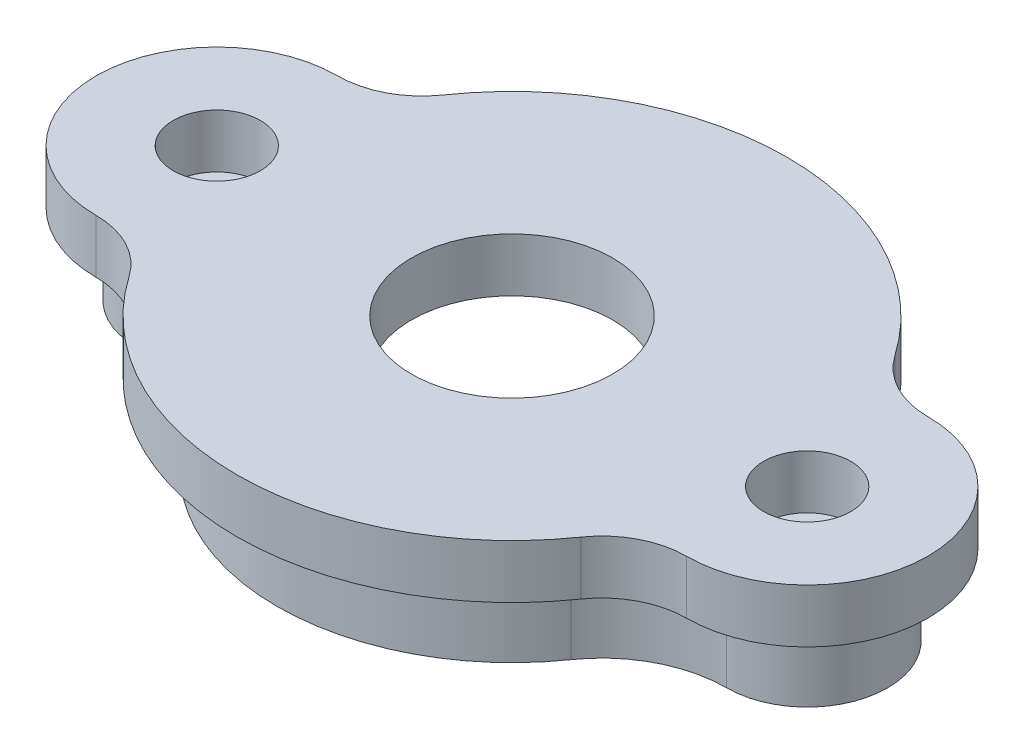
SolidWorks part; units mm, degrees
ref_plane "Ön Düzlem" through (0, 0, 0) normal (0, 0, 1) x (1, 0, 0)
ref_plane "Üst Düzlem" through (0, 0, 0) normal (0, 1, 0) x (1, 0, 0)
ref_plane "Sağ Düzlem" through (0, 0, 0) normal (1, 0, 0) x (0, 0, -1)
sketch "Sketch1" plane through (0, 0, 0) normal (0, 1, 0) x (1, 0, 0)
  line L0 (22, 9) -> (22, -9) construction
  line L1 (0, 0) -> (22, 0) construction
  line L2 (0, 0) -> (0, 20.5) construction
  arc A0 (-16.8325, -11.7012) -> (16.8325, -11.7012) centre (0, 0) ccw
  arc A2 (22, -9) -> (22, 9) centre (22, 0) ccw
  arc A3 (22, 9) -> (16.8325, 11.7012) centre (22, 15.2935) cw
  arc A4 (22, -9) -> (16.8325, -11.7012) centre (22, -15.2935) ccw
  arc A5 (-22, -9) -> (-16.8325, -11.7012) centre (-22, -15.2935) cw
  arc A6 (-22, -9) -> (-22, 9) centre (-22, 0) cw
  arc A7 (-22, 9) -> (-16.8325, 11.7012) centre (-22, 15.2935) ccw
  arc A8 (16.8325, 11.7012) -> (-16.8325, 11.7012) centre (0, 0) ccw
  dimension "D1" = 41
  dimension "D2" = 9
  dimension "D3" = 22
extrude "Boss-Extrude1" add sketch "Sketch1" along normal blind 4
sketch "Sketch2" plane through (0, 0, 0) normal (0, -1, 0) x (1, 0, 0)
  arc A0 (14.3692, 9.9888) -> (-14.3692, 9.9888) centre (0, 0) ccw
  arc A1 (-22, 6) -> (-14.3692, 9.9888) centre (-22, 15.2935) ccw
  arc A2 (-22, 6) -> (-22, -6) centre (-22, 0) ccw
  arc A3 (-14.3692, -9.9888) -> (-22, -6) centre (-22, -15.2935) ccw
  arc A4 (-14.3692, -9.9888) -> (14.3692, -9.9888) centre (0, 0) ccw
  arc A5 (22, -6) -> (14.3692, -9.9888) centre (22, -15.2935) ccw
  arc A6 (22, -6) -> (22, 6) centre (22, 0) ccw
  arc A7 (14.3692, 9.9888) -> (22, 6) centre (22, 15.2935) ccw
  arc A8 (22, -9) -> (16.8325, -11.7012) centre (22, -15.2935) ccw
  arc A9 (22, -9) -> (22, 9) centre (22, 0) ccw
  arc A10 (16.8325, 11.7012) -> (22, 9) centre (22, 15.2935) ccw
  arc A11 (16.8325, 11.7012) -> (-16.8325, 11.7012) centre (0, 0) ccw
  arc A12 (-22, 9) -> (-16.8325, 11.7012) centre (-22, 15.2935) ccw
  arc A13 (-22, 9) -> (-22, -9) centre (-22, 0) ccw
  arc A14 (-16.8325, -11.7012) -> (-22, -9) centre (-22, -15.2935) ccw
  arc A15 (-16.8325, -11.7012) -> (16.8325, -11.7012) centre (0, 0) ccw
  arc A16 (22, -9) -> (16.8325, -11.7012) centre (22, -15.2935) ccw
  arc A17 (22, -9) -> (22, 9) centre (22, 0) ccw
  arc A18 (16.8325, 11.7012) -> (22, 9) centre (22, 15.2935) ccw
  arc A19 (16.8325, 11.7012) -> (-16.8325, 11.7012) centre (0, 0) ccw
  arc A20 (-22, 9) -> (-16.8325, 11.7012) centre (-22, 15.2935) ccw
  arc A21 (-22, 9) -> (-22, -9) centre (-22, 0) ccw
  arc A22 (-16.8325, -11.7012) -> (-22, -9) centre (-22, -15.2935) ccw
  arc A23 (-16.8325, -11.7012) -> (16.8325, -11.7012) centre (0, 0) ccw
  dimension "D2" = 6
  dimension "D1" = 0
extrude "Boss-Extrude2" add sketch "Sketch2" along normal blind 6 contours A7 A0 A1 A2 A3 A4 A5 A6
hole_wizard "Hole1" positions "Sketch3" profile "Sketch4" legacy
sketch "Sketch3" plane through (0, 4, 0) normal (0, 1, 0) x (1, 0, 0)
  point P0 (22, 0)
  point P3 (-22, 0)
sketch "Sketch4" plane through (22, 4, 0) normal (1, 0, 0) x (0, 0, 1)
  line L0 (0, 0) -> (0, 10)
  line L1 (0, 10) -> (1.75, 10)
  line L2 (1.75, 10) -> (1.75, 4)
  line L3 (1.75, 4) -> (3.25, 4)
  line L4 (3.25, 4) -> (3.25, 0)
  line L5 (3.25, 0) -> (0, 0)
  line L6 (0, 110) -> (0, -10) construction
  dimension "Diameter" = 3.5
  dimension "Depth" = 10
  dimension "C-Bore Diameter" = 6.5
  dimension "C-Bore Depth" = 4
hole_wizard "Hole2" positions "Sketch6" profile "Sketch7" legacy
sketch "Sketch6" plane through (0, -6, 0) normal (0, -1, 0) x (-1, 0, 0)
  point P0 (0, 0)
sketch "Sketch7" plane through (0, -6, 0) normal (1, 0, 0) x (0, 0, -1)
  line L0 (0, 0) -> (0, 10)
  line L1 (0, 10) -> (7.5, 10)
  line L2 (7.5, 10) -> (7.5, 6)
  line L3 (7.5, 6) -> (16, 6)
  line L4 (16, 6) -> (16, 0)
  line L5 (16, 0) -> (0, 0)
  line L6 (0, 110) -> (0, -10) construction
  dimension "Diameter" = 15
  dimension "Depth" = 10
  dimension "C-Bore Diameter" = 32
  dimension "C-Bore Depth" = 6
